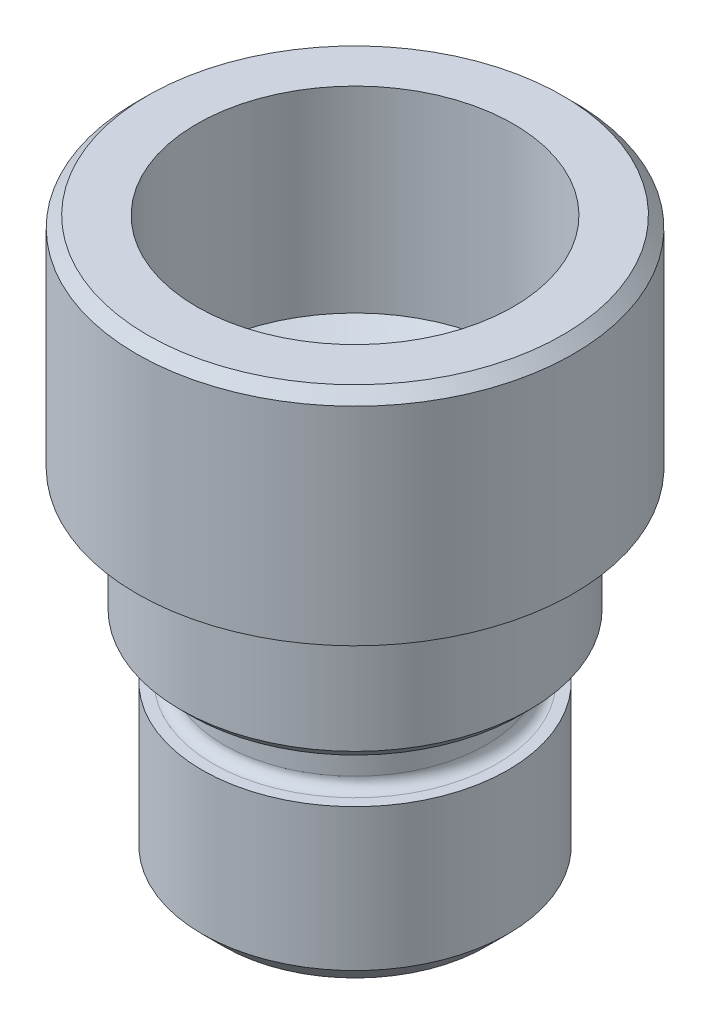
SolidWorks part; units mm, degrees
ref_plane "Piano frontale" through (0, 0, 0) normal (0, 0, 1) x (1, 0, 0)
ref_plane "Piano superiore" through (0, 0, 0) normal (0, 1, 0) x (1, 0, 0)
ref_plane "Piano destro" through (0, 0, 0) normal (1, 0, 0) x (0, 0, -1)
ref_plane "Piano1" through (0, 0, 0) normal (0, 0, -1) x (-1, 0, 0)
sketch "Schizzo1" plane through (0, 0, 0) normal (0, 0, -1) x (-1, 0, 0)
  line L0 (-6.5, 7.5) -> (-7, 7.5)
  line L1 (-7, 7.5) -> (-7, 1)
  line L2 (-7, 1) -> (-6, 0)
  line L3 (-6, 0) -> (-5, 0)
  line L4 (-5, 0) -> (-5, 17.0987)
  line L5 (-5, 17.0987) -> (-6.5, 18)
  line L6 (-6.5, 18) -> (-6.5, 26)
  line L7 (-6.5, 26) -> (-9.5, 26)
  line L8 (-9.5, 26) -> (-10, 25.5)
  line L9 (-10, 25.5) -> (-10, 16)
  line L10 (-10, 16) -> (-8, 16)
  line L11 (-8, 16) -> (-8, 10.4)
  line L12 (-8, 10.4) -> (-7.5, 9.9)
  line L13 (-7.5, 9.9) -> (-6.5, 9.9)
  line L14 (-6, 9.4) -> (-6, 8)
  line L15 (0, 0) -> (0, 26) construction
  arc A0 (-6, 8) -> (-6.5, 7.5) centre (-6.5, 8) cw
  arc A1 (-6.5, 9.9) -> (-6, 9.4) centre (-6.5, 9.4) cw
  dimension "D7" = 0.5
  dimension "D8" = 0.5
  dimension "D1" = 10
  dimension "D2" = 14
  dimension "D3" = 16
  dimension "D4" = 20
  dimension "D5" = 135
  dimension "D6" = 1
  dimension "D9" = 2.4
  dimension "D10" = 12
  dimension "D11" = 135
  dimension "D12" = 0.5
  dimension "D13" = 7.5
  dimension "D14" = 59
  dimension "D15" = 13
  dimension "D16" = 135
  dimension "D17" = 0.5
  dimension "D18" = 8
  dimension "D19" = 10
  dimension "D20" = 16
revolve "Rivoluzione1" add sketch "Schizzo1" angle 360 about L15
hole_wizard "M16x1.5 Foro filettato profondo1" positions "Schizzo4" profile "Schizzo6" tap size "M16x1.5" standard "ISO"
sketch "Schizzo4" plane through (0, 26, 0) normal (0, 1, 0) x (-1, 0, 0)
  point P1 (0, 0)
sketch "Schizzo6" plane through (0, 26, 0) normal (1, 0, 0) x (0, 0, 1)
  line L0 (0, 0) -> (0, 13.3562)
  line L1 (0, 13.3562) -> (7.25, 9)
  line L2 (7.25, 9) -> (7.25, 0)
  line L5 (7.25, 0) -> (0, 0)
  line L10 (0, 13.3562) -> (-7.25, 9) construction
  line L11 (0, -6.35) -> (0, 107.95) construction
  dimension "Tap Drill Dia." = 14.5
  dimension "Tap Drill Depth" = 9
  dimension "Drill Angle" = 118
